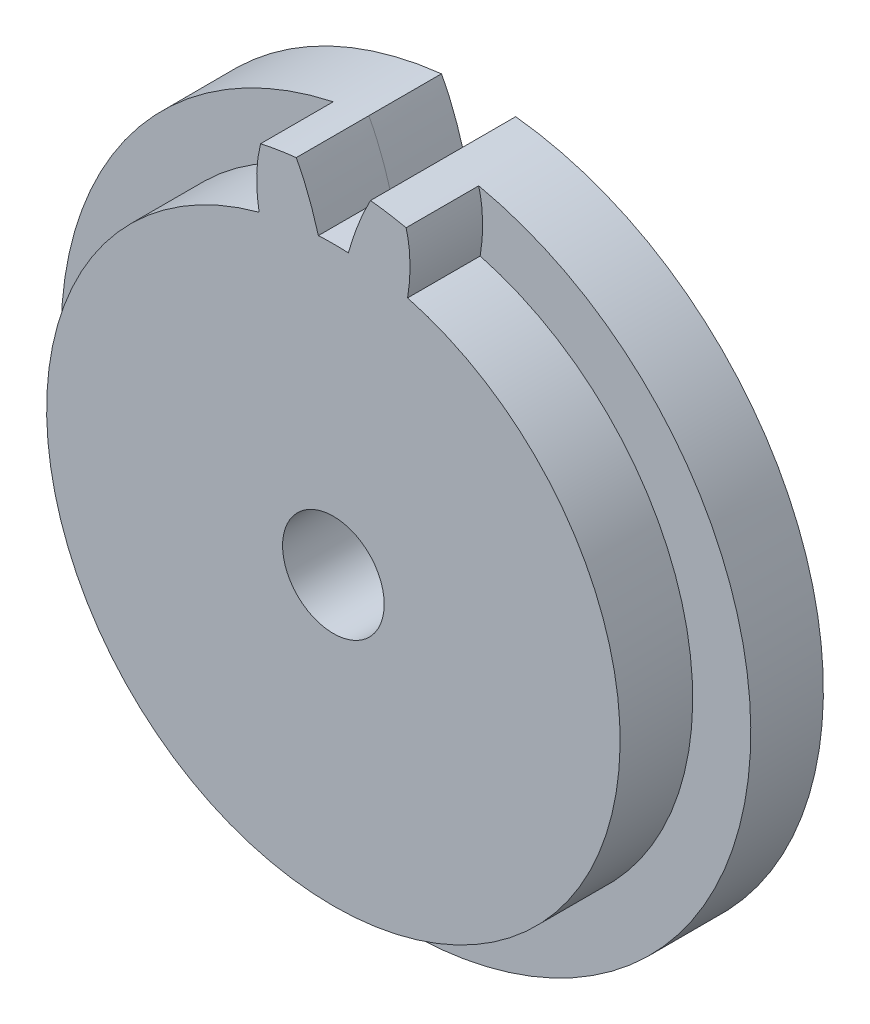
SolidWorks part; units mm, degrees
ref_plane "前基準面" through (0, 0, 0) normal (0, 0, 1) x (1, 0, 0)
ref_plane "上基準面" through (0, 0, 0) normal (0, 1, 0) x (1, 0, 0)
ref_plane "右基準面" through (0, 0, 0) normal (1, 0, 0) x (0, 0, -1)
sketch "草圖1" plane through (0, 0, 0) normal (0, 0, 1) x (1, 0, 0)
  line L0 (0, 0) -> (0, 50) construction
  line L1 (0, 0) -> (7.8217, 49.3844) construction
  line L2 (0, 0) -> (-7.8217, 49.3844) construction
  line L3 (0, 0) -> (-2.0673, 39.4459) construction
  line L4 (0, 0) -> (2.0673, 39.4459) construction
  line L5 (-6.6046, 49.5619) -> (-7.8217, 49.3844)
  line L6 (6.6046, 49.5619) -> (7.8217, 49.3844)
  circle A0 centre (0, 0) radius 7
  circle A1 centre (0, 0) radius 39.5
  circle A2 centre (0, 0) radius 45 construction
  circle A3 centre (0, 0) radius 50 construction
  spline S0 degree 2 poles (-2.0673, 39.4459) (-3.913, 45.9463) (-6.6046, 49.5619) knots 0 0 0 1 1 1
  spline S1 degree 2 poles (2.0673, 39.4459) (3.913, 45.9463) (6.6046, 49.5619) knots 0 0 0 1 1 1
  dimension "D1" = 100
  dimension "D2" = 90
  dimension "D3" = 79
  dimension "D4" = 14
  dimension "D5" = 18
  dimension "D6" = 6
  dimension "D7" = 1.23
sketch "草圖2" plane through (0, 0, 0) normal (0, 0, 1) x (1, 0, 0)
  line L0 (0, 63) -> (0, 45) construction
  line L1 (0, 63) -> (-6.8883, 46.3702) construction
  line L2 (0, 63) -> (6.8883, 46.3702) construction
  line L3 (0, 63) -> (-3.4455, 50.9842) construction
  line L4 (0, 63) -> (3.4455, 50.9842) construction
  line L5 (-1.625, 40) -> (1.625, 40)
  circle A0 centre (0, 63) radius 5
  circle A1 centre (0, 63) radius 12.5
  circle A2 centre (0, 63) radius 18 construction
  circle A3 centre (0, 0) radius 45 construction
  spline S0 degree 2 poles (-1.625, 40) (-3.7444, 45.5391) (-3.4455, 50.9842) knots 0 0 0 1 1 1
  spline S1 degree 2 poles (1.625, 40) (3.7444, 45.5391) (3.4455, 50.9842) knots 0 0 0 1 1 1
  point P14 (0, 40)
  dimension "D2" = 10
  dimension "D3" = 25
  dimension "D1" = 63
  dimension "D4" = 45
  dimension "D5" = 32
  dimension "D6" = 3.25
  dimension "D7" = 23
sketch "草圖3" plane through (0, 0, 0) normal (0, 0, 1) x (1, 0, 0)
  circle A0 centre (0, 0) radius 39.5 construction
  arc A1 (2.0673, 39.4459) -> (-2.0673, 39.4459) centre (0, 0) ccw
  arc A2 (14.1555, 36.8764) -> (10.2234, 38.1541) centre (0, 0) ccw
  arc A3 (24.8582, 30.6973) -> (21.5132, 33.1275) centre (0, 0) ccw
  arc A4 (33.1275, 21.5132) -> (30.6973, 24.8582) centre (0, 0) ccw
  arc A5 (38.1541, 10.2234) -> (36.8764, 14.1555) centre (0, 0) ccw
  arc A6 (39.4459, -2.0673) -> (39.4459, 2.0673) centre (0, 0) ccw
  arc A7 (36.8764, -14.1555) -> (38.1541, -10.2234) centre (0, 0) ccw
  arc A8 (30.6973, -24.8582) -> (33.1275, -21.5132) centre (0, 0) ccw
  arc A9 (21.5132, -33.1275) -> (24.8582, -30.6973) centre (0, 0) ccw
  arc A10 (10.2234, -38.1541) -> (14.1555, -36.8764) centre (0, 0) ccw
  arc A11 (-2.0673, -39.4459) -> (2.0673, -39.4459) centre (0, 0) ccw
  arc A12 (-14.1555, -36.8764) -> (-10.2234, -38.1541) centre (0, 0) ccw
  arc A13 (-24.8582, -30.6973) -> (-21.5132, -33.1275) centre (0, 0) ccw
  arc A14 (-33.1275, -21.5132) -> (-30.6973, -24.8582) centre (0, 0) ccw
  arc A15 (-38.1541, -10.2234) -> (-36.8764, -14.1555) centre (0, 0) ccw
  arc A16 (-39.4459, 2.0673) -> (-39.4459, -2.0673) centre (0, 0) ccw
  arc A17 (-36.8764, 14.1555) -> (-38.1541, 10.2234) centre (0, 0) ccw
  arc A18 (-30.6973, 24.8582) -> (-33.1275, 21.5132) centre (0, 0) ccw
  arc A19 (-21.5132, 33.1275) -> (-24.8582, 30.6973) centre (0, 0) ccw
  arc A20 (-10.2234, 38.1541) -> (-14.1555, 36.8764) centre (0, 0) ccw
  circle A21 centre (0, 0) radius 50 construction
  arc A22 (9.0341, 49.1771) -> (6.6046, 49.5619) centre (0, 0) ccw
  arc A23 (23.7885, 43.9785) -> (21.5968, 45.0952) centre (0, 0) ccw
  arc A24 (36.2143, 34.475) -> (34.475, 36.2143) centre (0, 0) ccw
  arc A25 (45.0952, 21.5968) -> (43.9785, 23.7885) centre (0, 0) ccw
  arc A26 (49.5619, 6.6046) -> (49.1771, 9.0341) centre (0, 0) ccw
  arc A27 (49.1771, -9.0341) -> (49.5619, -6.6046) centre (0, 0) ccw
  arc A28 (43.9785, -23.7885) -> (45.0952, -21.5968) centre (0, 0) ccw
  arc A29 (34.475, -36.2143) -> (36.2143, -34.475) centre (0, 0) ccw
  arc A30 (21.5968, -45.0952) -> (23.7885, -43.9785) centre (0, 0) ccw
  arc A31 (6.6046, -49.5619) -> (9.0341, -49.1771) centre (0, 0) ccw
  arc A32 (-9.0341, -49.1771) -> (-6.6046, -49.5619) centre (0, 0) ccw
  arc A33 (-23.7885, -43.9785) -> (-21.5968, -45.0952) centre (0, 0) ccw
  arc A34 (-36.2143, -34.475) -> (-34.475, -36.2143) centre (0, 0) ccw
  arc A35 (-45.0952, -21.5968) -> (-43.9785, -23.7885) centre (0, 0) ccw
  arc A36 (-49.5619, -6.6046) -> (-49.1771, -9.0341) centre (0, 0) ccw
  arc A37 (-49.1771, 9.0341) -> (-49.5619, 6.6046) centre (0, 0) ccw
  arc A38 (-43.9785, 23.7885) -> (-45.0952, 21.5968) centre (0, 0) ccw
  arc A39 (-34.475, 36.2143) -> (-36.2143, 34.475) centre (0, 0) ccw
  arc A40 (-21.5968, 45.0952) -> (-23.7885, 43.9785) centre (0, 0) ccw
  arc A41 (-6.6046, 49.5619) -> (-9.0341, 49.1771) centre (0, 0) ccw
  circle A42 centre (0, 0) radius 7 construction
  circle A43 centre (0, 0) radius 7
  parabola Q0 construction
  parabola Q1 construction
  parabola Q2
  parabola Q3
  parabola Q4
  parabola Q5
  parabola Q6
  parabola Q7
  parabola Q8
  parabola Q9
  parabola Q10
  parabola Q11
  parabola Q12
  parabola Q13
  parabola Q14
  parabola Q15
  parabola Q16
  parabola Q17
  parabola Q18
  parabola Q19
  parabola Q20
  parabola Q21
  parabola Q22
  parabola Q23
  parabola Q24
  parabola Q25
  parabola Q26
  parabola Q27
  parabola Q28
  parabola Q29
  parabola Q30
  parabola Q31
  parabola Q32
  parabola Q33
  parabola Q34
  parabola Q35
  parabola Q36
  parabola Q37
  parabola Q38
  parabola Q39
  parabola Q40
  parabola Q41
  point P168 (0, 0)
  dimension "D1" = 20
extrude "填料-伸長1" add sketch "草圖3" along normal blind 10
sketch "草圖4" plane through (0, 0, 0) normal (0, 0, 1) x (1, 0, 0)
  arc A0 (2.0673, 39.4459) -> (-2.0673, 39.4459) centre (0, 0) ccw construction
  arc A1 (2.0673, 39.4459) -> (-2.0673, 39.4459) centre (0, 0) ccw
  arc A2 (-6.6046, 49.5619) -> (6.6046, 49.5619) centre (0, 0) ccw
  circle A3 centre (0, 0) radius 7 construction
  circle A4 centre (0, 0) radius 7
  parabola Q0 construction
  parabola Q1 construction
  parabola Q2
  parabola Q3
extrude "填料-伸長2" add sketch "草圖4" against normal blind 10
sketch "草圖5" plane through (0, 0, 10) normal (0, 0, 1) x (1, 0, 0)
  arc A0 (-14.1555, 36.8764) -> (-21.5132, 33.1275) centre (0, 0) ccw
  arc A1 (-24.8582, 30.6973) -> (-30.6973, 24.8582) centre (0, 0) ccw
  arc A2 (-33.1275, 21.5132) -> (-36.8764, 14.1555) centre (0, 0) ccw
  arc A3 (-38.1541, 10.2234) -> (-39.4459, 2.0673) centre (0, 0) ccw
  arc A4 (-39.4459, -2.0673) -> (-38.1541, -10.2234) centre (0, 0) ccw
  arc A5 (-36.8764, -14.1555) -> (-33.1275, -21.5132) centre (0, 0) ccw
  arc A6 (-30.6973, -24.8582) -> (-24.8582, -30.6973) centre (0, 0) ccw
  arc A7 (-21.5132, -33.1275) -> (-14.1555, -36.8764) centre (0, 0) ccw
  arc A8 (-10.2234, -38.1541) -> (-2.0673, -39.4459) centre (0, 0) ccw
  arc A9 (2.0673, -39.4459) -> (10.2234, -38.1541) centre (0, 0) ccw
  arc A10 (14.1555, -36.8764) -> (21.5132, -33.1275) centre (0, 0) ccw
  arc A11 (24.8582, -30.6973) -> (30.6973, -24.8582) centre (0, 0) ccw
  arc A12 (33.1275, -21.5132) -> (36.8764, -14.1555) centre (0, 0) ccw
  arc A13 (38.1541, -10.2234) -> (39.4459, -2.0673) centre (0, 0) ccw
  arc A14 (39.4459, 2.0673) -> (38.1541, 10.2234) centre (0, 0) ccw
  arc A15 (36.8764, 14.1555) -> (33.1275, 21.5132) centre (0, 0) ccw
  arc A16 (30.6973, 24.8582) -> (24.8582, 30.6973) centre (0, 0) ccw
  arc A17 (21.5132, 33.1275) -> (14.1555, 36.8764) centre (0, 0) ccw
  arc A40 (2.0673, 39.4459) -> (-2.0673, 39.4459) centre (0, 0) ccw
  arc A41 (-6.6046, 49.5619) -> (-9.0341, 49.1771) centre (0, 0) ccw
  arc A42 (-10.2234, 38.1541) -> (-14.1555, 36.8764) centre (0, 0) ccw
  arc A43 (-21.5968, 45.0952) -> (-23.7885, 43.9785) centre (0, 0) ccw
  arc A44 (-21.5132, 33.1275) -> (-24.8582, 30.6973) centre (0, 0) ccw
  arc A45 (-34.475, 36.2143) -> (-36.2143, 34.475) centre (0, 0) ccw
  arc A46 (-30.6973, 24.8582) -> (-33.1275, 21.5132) centre (0, 0) ccw
  arc A47 (-43.9785, 23.7885) -> (-45.0952, 21.5968) centre (0, 0) ccw
  arc A48 (-36.8764, 14.1555) -> (-38.1541, 10.2234) centre (0, 0) ccw
  arc A49 (-49.1771, 9.0341) -> (-49.5619, 6.6046) centre (0, 0) ccw
  arc A50 (-39.4459, 2.0673) -> (-39.4459, -2.0673) centre (0, 0) ccw
  arc A51 (-49.5619, -6.6046) -> (-49.1771, -9.0341) centre (0, 0) ccw
  arc A52 (-38.1541, -10.2234) -> (-36.8764, -14.1555) centre (0, 0) ccw
  arc A53 (-45.0952, -21.5968) -> (-43.9785, -23.7885) centre (0, 0) ccw
  arc A54 (-33.1275, -21.5132) -> (-30.6973, -24.8582) centre (0, 0) ccw
  arc A55 (-36.2143, -34.475) -> (-34.475, -36.2143) centre (0, 0) ccw
  arc A56 (-24.8582, -30.6973) -> (-21.5132, -33.1275) centre (0, 0) ccw
  arc A57 (-23.7885, -43.9785) -> (-21.5968, -45.0952) centre (0, 0) ccw
  arc A58 (-14.1555, -36.8764) -> (-10.2234, -38.1541) centre (0, 0) ccw
  arc A59 (-9.0341, -49.1771) -> (-6.6046, -49.5619) centre (0, 0) ccw
  arc A60 (-2.0673, -39.4459) -> (2.0673, -39.4459) centre (0, 0) ccw
  arc A61 (6.6046, -49.5619) -> (9.0341, -49.1771) centre (0, 0) ccw
  arc A62 (10.2234, -38.1541) -> (14.1555, -36.8764) centre (0, 0) ccw
  arc A63 (21.5968, -45.0952) -> (23.7885, -43.9785) centre (0, 0) ccw
  arc A64 (21.5132, -33.1275) -> (24.8582, -30.6973) centre (0, 0) ccw
  arc A65 (34.475, -36.2143) -> (36.2143, -34.475) centre (0, 0) ccw
  arc A66 (30.6973, -24.8582) -> (33.1275, -21.5132) centre (0, 0) ccw
  arc A67 (43.9785, -23.7885) -> (45.0952, -21.5968) centre (0, 0) ccw
  arc A68 (36.8764, -14.1555) -> (38.1541, -10.2234) centre (0, 0) ccw
  arc A69 (49.1771, -9.0341) -> (49.5619, -6.6046) centre (0, 0) ccw
  arc A70 (39.4459, -2.0673) -> (39.4459, 2.0673) centre (0, 0) ccw
  arc A71 (49.5619, 6.6046) -> (49.1771, 9.0341) centre (0, 0) ccw
  arc A72 (38.1541, 10.2234) -> (36.8764, 14.1555) centre (0, 0) ccw
  arc A73 (45.0952, 21.5968) -> (43.9785, 23.7885) centre (0, 0) ccw
  arc A74 (33.1275, 21.5132) -> (30.6973, 24.8582) centre (0, 0) ccw
  arc A75 (36.2143, 34.475) -> (34.475, 36.2143) centre (0, 0) ccw
  arc A76 (24.8582, 30.6973) -> (21.5132, 33.1275) centre (0, 0) ccw
  arc A77 (23.7885, 43.9785) -> (21.5968, 45.0952) centre (0, 0) ccw
  arc A78 (14.1555, 36.8764) -> (10.2234, 38.1541) centre (0, 0) ccw
  arc A79 (9.0341, 49.1771) -> (6.6046, 49.5619) centre (0, 0) ccw
  arc A83 (-21.5968, 45.0952) -> (-23.7885, 43.9785) centre (0, 0) ccw
  arc A85 (-34.475, 36.2143) -> (-36.2143, 34.475) centre (0, 0) ccw
  arc A87 (-43.9785, 23.7885) -> (-45.0952, 21.5968) centre (0, 0) ccw
  arc A89 (-49.1771, 9.0341) -> (-49.5619, 6.6046) centre (0, 0) ccw
  arc A91 (-49.5619, -6.6046) -> (-49.1771, -9.0341) centre (0, 0) ccw
  arc A93 (-45.0952, -21.5968) -> (-43.9785, -23.7885) centre (0, 0) ccw
  arc A95 (-36.2143, -34.475) -> (-34.475, -36.2143) centre (0, 0) ccw
  arc A97 (-23.7885, -43.9785) -> (-21.5968, -45.0952) centre (0, 0) ccw
  arc A99 (-9.0341, -49.1771) -> (-6.6046, -49.5619) centre (0, 0) ccw
  arc A101 (6.6046, -49.5619) -> (9.0341, -49.1771) centre (0, 0) ccw
  arc A103 (21.5968, -45.0952) -> (23.7885, -43.9785) centre (0, 0) ccw
  arc A105 (34.475, -36.2143) -> (36.2143, -34.475) centre (0, 0) ccw
  arc A107 (43.9785, -23.7885) -> (45.0952, -21.5968) centre (0, 0) ccw
  arc A109 (49.1771, -9.0341) -> (49.5619, -6.6046) centre (0, 0) ccw
  arc A111 (49.5619, 6.6046) -> (49.1771, 9.0341) centre (0, 0) ccw
  arc A113 (45.0952, 21.5968) -> (43.9785, 23.7885) centre (0, 0) ccw
  arc A115 (36.2143, 34.475) -> (34.475, 36.2143) centre (0, 0) ccw
  arc A117 (23.7885, 43.9785) -> (21.5968, 45.0952) centre (0, 0) ccw
  parabola Q40
  parabola Q41
  parabola Q42
  parabola Q43
  parabola Q44
  parabola Q45
  parabola Q46
  parabola Q47
  parabola Q48
  parabola Q49
  parabola Q50
  parabola Q51
  parabola Q52
  parabola Q53
  parabola Q54
  parabola Q55
  parabola Q56
  parabola Q57
  parabola Q58
  parabola Q59
  parabola Q60
  parabola Q61
  parabola Q62
  parabola Q63
  parabola Q64
  parabola Q65
  parabola Q66
  parabola Q67
  parabola Q68
  parabola Q69
  parabola Q70
  parabola Q71
  parabola Q72
  parabola Q73
  parabola Q74
  parabola Q75
  parabola Q76
  parabola Q77
  parabola Q78
  parabola Q79
  parabola Q83
  parabola Q84
  parabola Q85
  parabola Q86
  parabola Q87
  parabola Q88
  parabola Q89
  parabola Q90
  parabola Q91
  parabola Q92
  parabola Q93
  parabola Q94
  parabola Q95
  parabola Q96
  parabola Q97
  parabola Q98
  parabola Q99
  parabola Q100
  parabola Q101
  parabola Q102
  parabola Q103
  parabola Q104
  parabola Q105
  parabola Q106
  parabola Q107
  parabola Q108
  parabola Q109
  parabola Q110
  parabola Q111
  parabola Q112
  parabola Q113
  parabola Q114
  parabola Q115
  parabola Q116
  parabola Q117
  parabola Q118
  dimension "D1" = 0
extrude "除料-伸長1" cut sketch "草圖5" against normal up to surface (10 mm away)
sketch "草圖6" plane through (0, 0, 0) normal (0, 0, 1) x (1, 0, 0)
  circle A0 centre (0, 0) radius 47.5
  circle A1 centre (0, 0) radius 57.5
  dimension "D1" = 95
  dimension "D2" = 10
extrude "除料-伸長2" cut sketch "草圖6" against normal through all both and the other way through all
